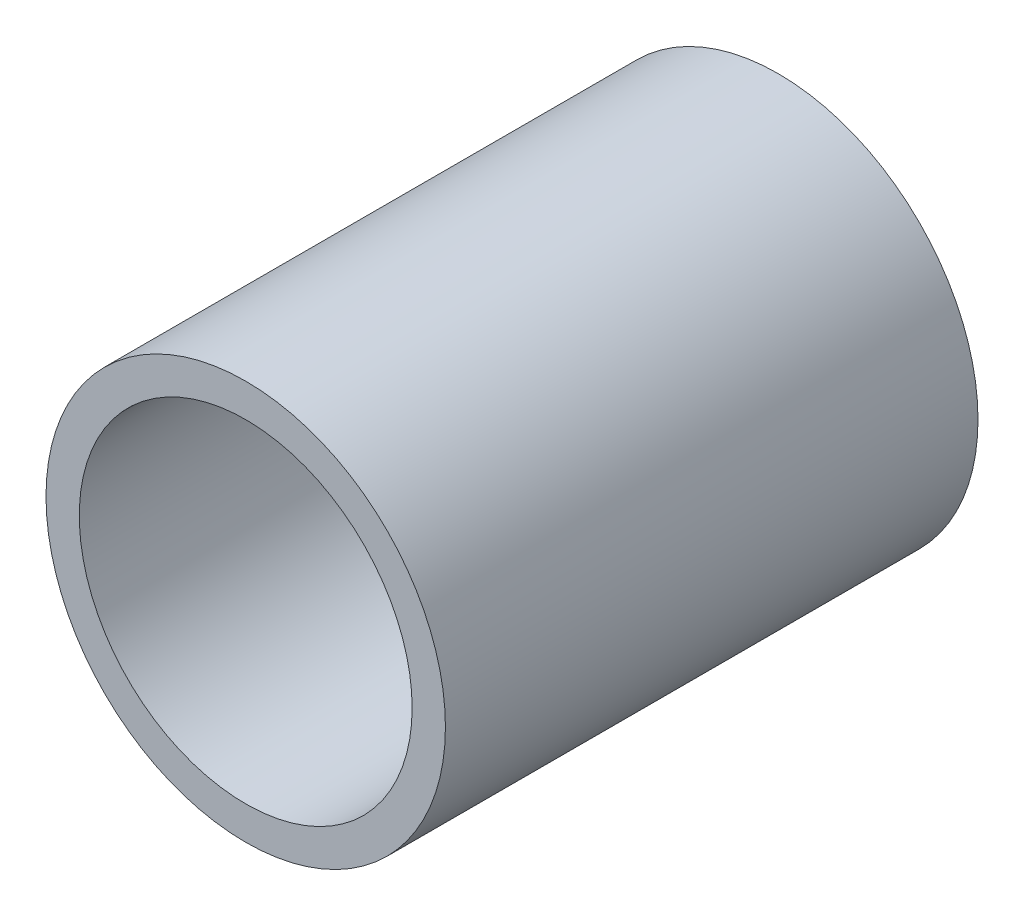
SolidWorks part; units mm, degrees
ref_plane "Front" through (0, 0, 0) normal (0, 0, 1) x (1, 0, 0)
ref_plane "Top" through (0, 0, 0) normal (0, 1, 0) x (1, 0, 0)
ref_plane "Right" through (0, 0, 0) normal (1, 0, 0) x (0, 0, -1)
sketch "Sketch1" plane through (0, 0, 0) normal (0, 0, 1) x (1, 0, 0)
  circle A0 centre (0, 0) radius 19.05
  circle A1 centre (0, 0) radius 15.875
  dimension "D1" = 38.1
  dimension "D2" = 31.75
extrude "Extrude1" add sketch "Sketch1" along normal blind 50.8
